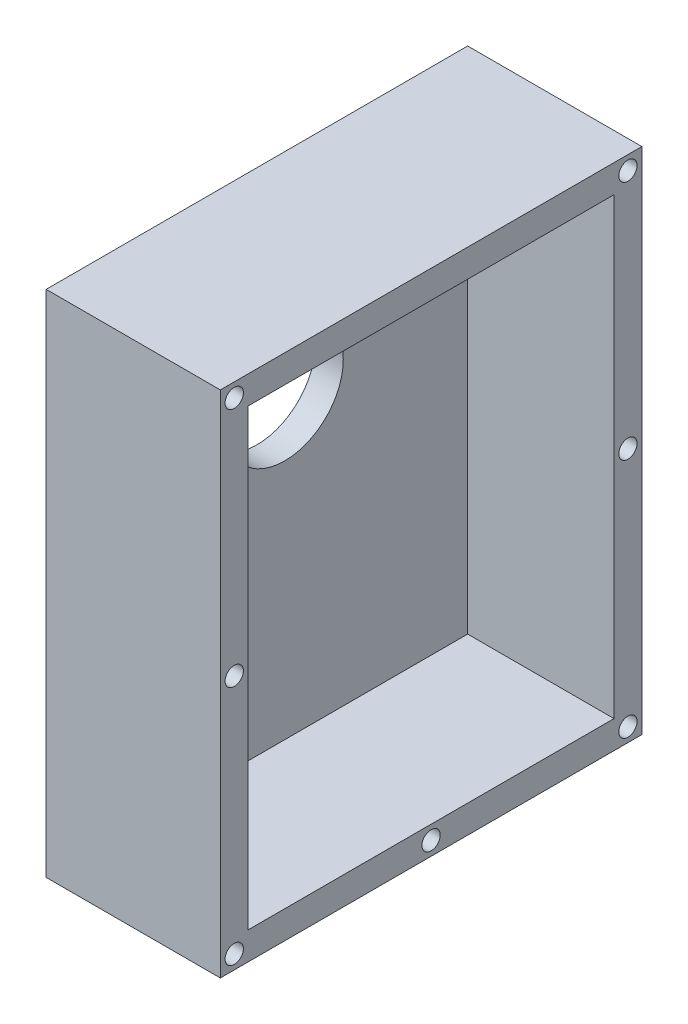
SolidWorks part; units mm, degrees
ref_plane "Front Plane" through (0, 0, 0) normal (1, 0, 0) x (0, 1, 0)
ref_plane "Top Plane" through (0, 0, 0) normal (0, 0, 1) x (0, 1, 0)
ref_plane "Right Plane" through (0, 0, 0) normal (0, 1, 0) x (-1, 0, 0)
sketch "Sketch3" plane through (0, 0, 0) normal (1, 0, 0) x (0, 1, 0)
  line L1 (0, 0) -> (39.37, 0)
  line L2 (0, 0) -> (0, 31.75)
  line L3 (0, 31.75) -> (39.37, 31.75)
  line L4 (39.37, 0) -> (39.37, 31.75)
extrude "Boss-Extrude2" add sketch "Sketch3" along normal blind 12.7
shell "Shell13" thickness 2.413
sketch "Sketch7" plane through (0, 0, 0) normal (1, 0, 0) x (0, 0, -1)
  line L0 (-15.875, 0) -> (-15.875, 39.37) construction
  line L1 (-31.75, 0) -> (0, 0) construction
  line L2 (0, 39.37) -> (-31.75, 39.37) construction
  line L3 (0, 19.685) -> (-31.75, 19.685) construction
  line L4 (0, 0) -> (0, 39.37) construction
  line L5 (-31.75, 39.37) -> (-31.75, 0) construction
  circle A0 centre (-15.875, 26.035) radius 5.08
  point P14 (-11.43, 27.0272)
  point P15 (-11.43, 27.0272)
  dimension "D2" = 10.16
  dimension "D1" = 6.35
extrude "Cut-Extrude1" cut sketch "Sketch7" against normal through all both and the other way through all
sketch "Sketch9" plane through (12.7, 0, 0) normal (1, 0, 0) x (0, 1, 0)
  line L0 (19.685, 34.163) -> (19.685, -2.413) construction
  line L1 (41.783, 34.163) -> (-2.413, 34.163) construction
  line L2 (-2.413, -2.413) -> (41.783, -2.413) construction
  line L3 (19.685, 15.875) -> (-2.413, 15.875) construction
  line L4 (-2.413, 34.163) -> (-2.413, -2.413) construction
  line L5 (-2.413, 15.875) -> (41.783, 15.875) construction
  line L6 (41.783, -2.413) -> (41.783, 34.163) construction
  line L7 (19.685, 34.163) -> (19.685, 31.75) construction
  line L8 (39.37, 31.75) -> (0, 31.75) construction
  line L9 (19.685, 32.9565) -> (41.783, 32.9565) construction
  line L11 (19.685, -2.413) -> (19.685, 0) construction
  line L12 (6.985, 0) -> (-6.985, 0) construction
  line L13 (19.685, -1.2065) -> (41.783, -1.2065) construction
  line L16 (-2.413, 15.875) -> (0, 15.875) construction
  line L17 (0, 31.75) -> (0, 0) construction
  line L20 (39.37, 15.875) -> (41.783, 15.875) construction
  line L21 (39.37, 0) -> (39.37, 31.75) construction
  line L22 (40.5765, 15.875) -> (40.5765, 34.163) construction
  line L23 (40.5765, 15.875) -> (40.5765, -2.413) construction
  circle A0 centre (40.5765, 32.9565) radius 0.7937
  circle A1 centre (19.685, 32.9565) radius 0.7937
  circle A2 centre (-1.2065, 32.9565) radius 0.7937
  circle A3 centre (-1.2065, 15.875) radius 0.7937
  circle A4 centre (-1.2065, -1.2065) radius 0.7937
  circle A5 centre (19.685, -1.2065) radius 0.7937
  circle A6 centre (40.5765, -1.2065) radius 0.7937
  dimension "D9" = 1.5875
  dimension "D1" = 17.0815
  dimension "D2" = 20.8915
  dimension "D3" = 20.8915
  dimension "D4" = 17.0815
  dimension "D5" = 17.0815
  dimension "D6" = 20.8915
  dimension "D7" = 20.8915
  dimension "D8" = 41.783
  dimension "D10" = 20.8915
extrude "Cut-Extrude2" cut sketch "Sketch9" against normal blind 7.62
equation "\"D1@Sketch3\"=1.25"
equation "\"D2@Sketch3\"=1.55"
equation "\"D1@Boss-Extrude2\"=0.50in"
